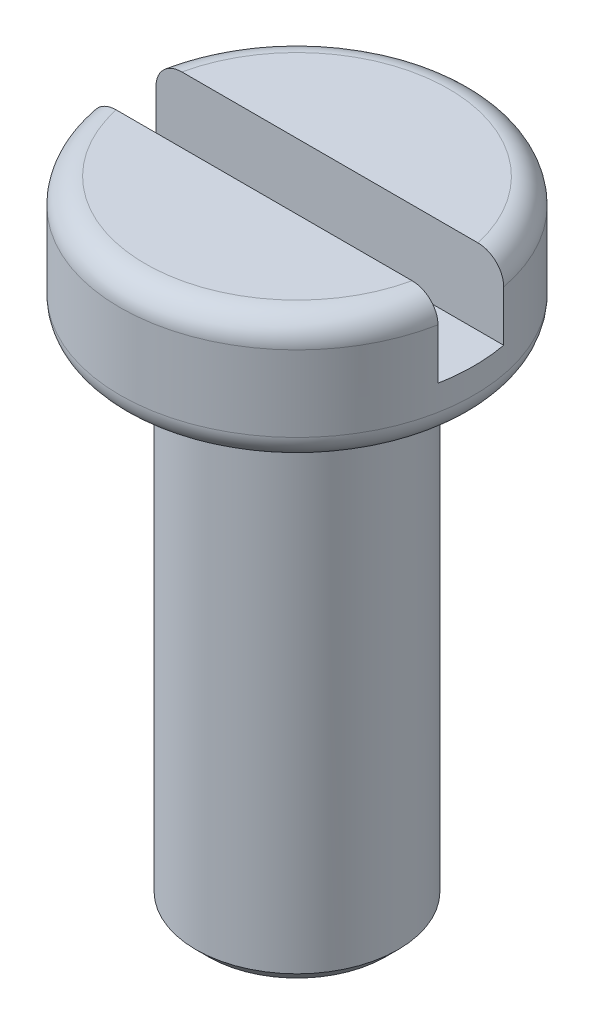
SolidWorks part; units mm, degrees
ref_plane "Plan de face" through (0, 0, 0) normal (0, 0, 1) x (1, 0, 0)
ref_plane "Plan de dessus" through (0, 0, 0) normal (0, 1, 0) x (1, 0, 0)
ref_plane "Plan de droite" through (0, 0, 0) normal (1, 0, 0) x (0, 0, -1)
sketch "Esquisse1" plane through (0, 0, 0) normal (0, 1, 0) x (1, 0, 0)
  circle A0 centre (0, 0) radius 3.5
  dimension "D1" = 7
extrude "Boss.-Extru.1" add sketch "Esquisse1" along normal blind 2.5
sketch "Esquisse2" plane through (0, 2.5, 0) normal (0, 1, 0) x (1, 0, 0)
  line L0 (-3.5, 0) -> (3.5, 0) construction
  line L1 (-3.4391, 0.65) -> (3.4391, 0.65)
  line L2 (-3.4391, -0.65) -> (3.4391, -0.65)
  circle A0 centre (0, 0) radius 3.5 construction
  arc A1 (-3.4391, 0.65) -> (-3.4391, -0.65) centre (0, 0) ccw
  arc A2 (3.4391, 0.65) -> (3.4391, -0.65) centre (0, 0) cw
  dimension "D1" = 1.3
extrude "Enlèv. mat.-Extru.1" cut sketch "Esquisse2" against normal blind 1.5
fillet "Congé1" radius 0.5 3 edges at (0, 0, 3.5) (0, 2.5, 3.5) (0, 2.5, -3.5)
sketch "Esquisse3" plane through (0, 0, 0) normal (0, -1, 0) x (1, 0, 0)
  circle A0 centre (0, 0) radius 2
  dimension "D1" = 4
extrude "Boss.-Extru.2" add sketch "Esquisse3" along normal blind 10
chamfer "Chanfrein1" distance 0.25 angle 45 1 edges at (0, -10, -2)
